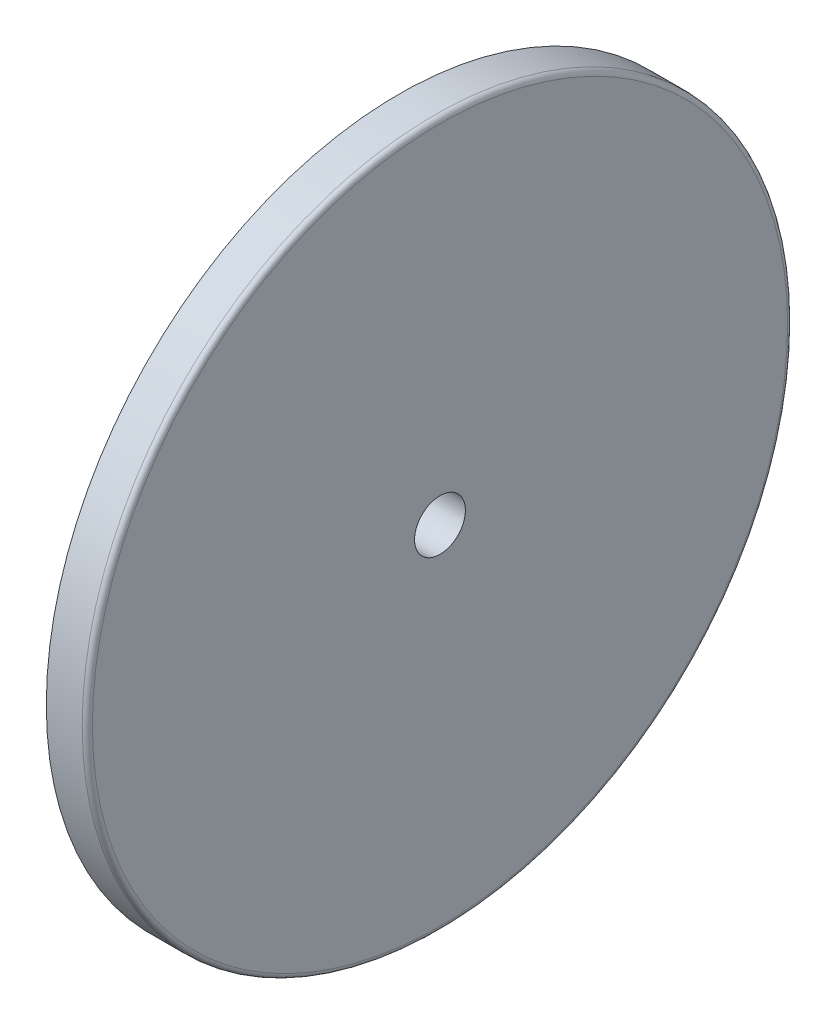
SolidWorks part; units mm, degrees
ref_plane "Front" through (0, 0, 0) normal (0, 0, 1) x (1, 0, 0)
ref_plane "Top" through (0, 0, 0) normal (0, 1, 0) x (1, 0, 0)
ref_plane "Right" through (0, 0, 0) normal (1, 0, 0) x (0, 0, -1)
sketch "Sketch2" plane through (0, 0, 0) normal (0, 0, 1) x (1, 0, 0)
  line L0 (5.9944, 31.115) -> (5.9944, 31.369)
  line L1 (5.9944, 31.369) -> (5.7404, 31.369)
  line L7 (5.9753, 25.3682) -> (4.0449, 25.3682)
  line L8 (3.2512, 24.5745) -> (3.2512, 3.9687)
  line L9 (5.0038, 55.0418) -> (5.0038, 54.102)
  line L11 (10.6062, 55.0418) -> (5.0038, 55.0418)
  line L13 (11.4, 54.248) -> (11.4, 3.9688)
  line L14 (0, 0) -> (78.0205, 0) construction
  line L24 (10.0076, 36.6395) -> (10.0076, 54.102)
  line L26 (10.0076, 54.102) -> (5.0038, 54.102)
  line L30 (10.0076, 36.6395) -> (5.7404, 36.6395)
  line L37 (5.7404, 31.369) -> (5.7404, 36.6395)
  line L39 (5.9753, 25.3682) -> (5.9753, 31.115)
  line L51 (11.4, 3.9688) -> (3.2512, 3.9687)
  line L54 (5.9753, 31.115) -> (5.9944, 31.115)
  arc A1 (11.4, 54.248) -> (10.6062, 55.0418) centre (10.6062, 54.248) ccw
  arc A2 (4.0449, 25.3682) -> (3.2512, 24.5745) centre (4.0449, 24.5745) ccw
  dimension "D6" = 0.7937
  dimension "D14" = 0.7938
  dimension "D1" = 3.9688
  dimension "D2" = 3.2512
  dimension "D3" = 11.4
  dimension "D4" = 2.7241
  dimension "D5" = 21.3995
  dimension "D7" = 31.115
  dimension "D8" = 36.6395
  dimension "D9" = 54.102
  dimension "D10" = 55.0418
  dimension "D11" = 10.0076
  dimension "D12" = 5.7404
  dimension "D13" = 5.0038
  dimension "D15" = 0.254
revolve "Revolve1" add sketch "Sketch2" angle 360 about L14
